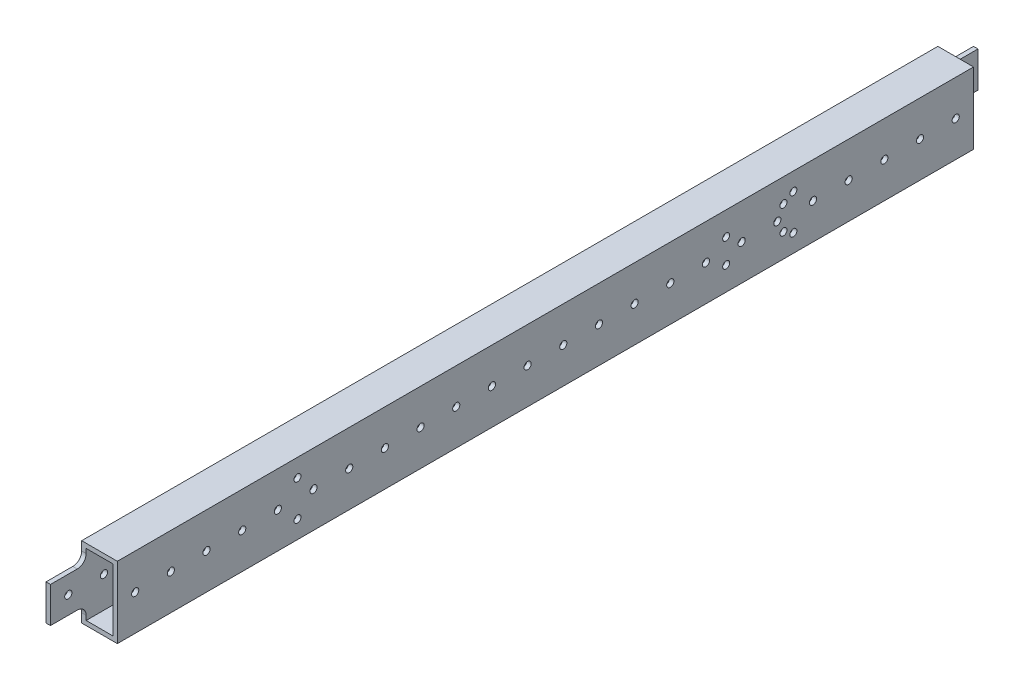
SolidWorks part; units mm, degrees
ref_plane "Front" through (0, 0, 0) normal (0, 0, 1) x (1, 0, 0)
ref_plane "Top" through (0, 0, 0) normal (0, 1, 0) x (1, 0, 0)
ref_plane "Right" through (0, 0, 0) normal (1, 0, 0) x (0, 0, -1)
sketch "Sketch1" plane through (0, 0, 0) normal (0, 0, 1) x (1, 0, 0)
  line L0 (3.175, 47.625) -> (22.225, 47.625)
  line L1 (0, 0) -> (25.4, 0)
  line L2 (0, 0) -> (0, 50.8)
  line L3 (0, 50.8) -> (25.4, 50.8)
  line L4 (25.4, 0) -> (25.4, 50.8)
  line L5 (22.225, 3.175) -> (22.225, 47.625)
  line L6 (3.175, 3.175) -> (22.225, 3.175)
  line L7 (3.175, 3.175) -> (3.175, 47.625)
  dimension "D1" = 25.4
  dimension "D2" = 50.8
  dimension "D3" = 3.175
extrude "Boss-Extrude1" add sketch "Sketch1" along normal blind 660.4
sketch "Sketch2" plane through (0, 50.8, 0) normal (0, 1, 0) x (1, 0, 0)
  line L0 (0, -660.4) -> (0, 0) construction
  line L1 (25.4, 0) -> (3.175, 0)
  line L2 (25.4, 0) -> (25.4, -25.4)
  line L3 (25.4, -25.4) -> (3.175, -25.4)
  line L4 (3.175, 0) -> (3.175, -25.4)
  line L5 (25.4, -660.4) -> (3.175, -660.4)
  line L6 (25.4, -660.4) -> (25.4, -635)
  line L7 (25.4, -635) -> (3.175, -635)
  line L8 (3.175, -660.4) -> (3.175, -635)
  dimension "D1" = 25.4
  dimension "D3" = 3.175
  dimension "D4" = 3.175
extrude "Cut-Extrude1" cut sketch "Sketch2" against normal through all
sketch "Sketch3" plane through (0, 0, 0) normal (-1, 0, 0) x (0, 0, 1)
  line L0 (660.4, 50.8) -> (660.4, 0) construction
  line L1 (660.4, 50.8) -> (0, 50.8) construction
  line L2 (0, 50.8) -> (0, 0) construction
  circle A0 centre (647.7, 25.4) radius 2.5527
  circle A1 centre (12.7, 25.4) radius 2.5527
  point P4 (660.4, 25.4)
  dimension "D1" = 5.1054
  dimension "D2" = 12.7
  dimension "D3" = 25.4
  dimension "D4" = 12.7
extrude "Cut-Extrude2" cut sketch "Sketch3" against normal through all
pattern_linear "LPattern1" count 25 spacing 25.4 along (0, 0, -1) of "Cut-Extrude2"
sketch "Sketch4" plane through (3.175, 0, 0) normal (1, 0, 0) x (0, 0, -1)
  line L0 (-25.4, 0) -> (-25.4, 50.8) construction
  line L1 (0, 50.8) -> (-25.4, 50.8)
  line L2 (0, 50.8) -> (0, 38.1)
  line L3 (0, 38.1) -> (-19.05, 38.1)
  line L4 (-25.4, 50.8) -> (-25.4, 44.45)
  line L5 (0, 25.4) -> (-5.3415, 25.4) construction
  line L6 (0, 50.8) -> (0, 0) construction
  line L7 (-330.2, 50.8) -> (-330.2, 38.1) construction
  line L8 (-635, 50.8) -> (-25.4, 50.8) construction
  line L9 (-25.4, 0) -> (-25.4, 6.35)
  line L10 (0, 12.7) -> (-19.05, 12.7)
  line L11 (0, 0) -> (0, 12.7)
  line L12 (0, 0) -> (-25.4, 0)
  line L21 (-660.4, 25.4) -> (-655.0585, 25.4) construction
  line L22 (-660.4, 0) -> (-635, 0)
  line L23 (-660.4, 0) -> (-660.4, 12.7)
  line L24 (-660.4, 12.7) -> (-641.35, 12.7)
  line L25 (-635, 0) -> (-635, 6.35)
  line L26 (-635, 50.8) -> (-635, 44.45)
  line L27 (-660.4, 38.1) -> (-641.35, 38.1)
  line L28 (-660.4, 50.8) -> (-660.4, 38.1)
  line L29 (-660.4, 50.8) -> (-635, 50.8)
  arc A0 (-19.05, 38.1) -> (-25.4, 44.45) centre (-19.05, 44.45) cw
  arc A1 (-19.05, 12.7) -> (-25.4, 6.35) centre (-19.05, 6.35) ccw
  arc A4 (-641.35, 12.7) -> (-635, 6.35) centre (-641.35, 6.35) cw
  arc A5 (-641.35, 38.1) -> (-635, 44.45) centre (-641.35, 44.45) ccw
  point P9 (-25.4, 38.1)
  point P24 (-25.4, 12.7)
  point P39 (-635, 12.7)
  point P40 (-635, 38.1)
  dimension "D1" = 6.35
  dimension "D2" = 12.7
extrude "Cut-Extrude3" cut sketch "Sketch4" against normal through all
sketch "Sketch6" plane through (0, 0, 0) normal (-1, 0, 0) x (0, 0, 1)
  line L0 (635, 50.8) -> (25.4, 50.8) construction
  line L1 (635, 0) -> (25.4, 0) construction
  line L2 (660.4, 38.1) -> (660.4, 12.7) construction
  line L3 (330.2, 0) -> (330.2, 50.8) construction
  circle A2 centre (506.7375, 12.7) radius 2.4892
  circle A3 centre (506.7375, 38.1) radius 2.4892
  circle A5 centre (153.6625, 38.1) radius 2.4892
  circle A6 centre (153.6625, 12.7) radius 2.4892
  dimension "D3" = 4.9784
  dimension "D1" = 12.7
  dimension "D2" = 12.7
  dimension "D4" = 153.6625
extrude "Cut-Extrude4" cut sketch "Sketch6" against normal through all
sketch "Sketch8" plane through (0, 0, 0) normal (-1, 0, 0) x (0, 0, 1)
  circle A0 centre (160.7237, 16.7894) radius 2.0193
  circle A1 centre (160.7237, 34.0106) radius 2.0193
  circle A2 centre (201.5161, 34.0106) radius 2.0193
  circle A3 centre (201.5161, 16.7894) radius 2.0193
  circle A4 centre (153.6625, 38.1) radius 2.4892 construction
  circle A5 centre (153.6625, 12.7) radius 2.4892 construction
  dimension "D1" = 4.0386
  dimension "D4" = 4.0894
  dimension "D2" = 7.0612
  dimension "D3" = 4.0894
  dimension "D5" = 40.7924
extrude "Cut-Extrude5" cut sketch "Sketch8" against normal blind 25.4
sketch "Sketch9" plane through (25.4, 0, 0) normal (1, 0, 0) x (0, 0, -1)
  circle A0 centre (-201.5161, 34.0106) radius 2.4892
  circle A1 centre (-160.7237, 34.0106) radius 2.4892
  circle A2 centre (-160.7237, 16.7894) radius 2.4892
  circle A3 centre (-201.5161, 16.7894) radius 2.4892
  circle A4 centre (-160.7237, 34.0106) radius 2.0193 construction
  circle A5 centre (-201.5161, 34.0106) radius 2.0193 construction
  circle A6 centre (-201.5161, 16.7894) radius 2.0193 construction
  circle A7 centre (-160.7237, 16.7894) radius 2.0193 construction
  dimension "D1" = 4.9784
extrude "Cut-Extrude6" cut sketch "Sketch9" against normal blind 3.175
